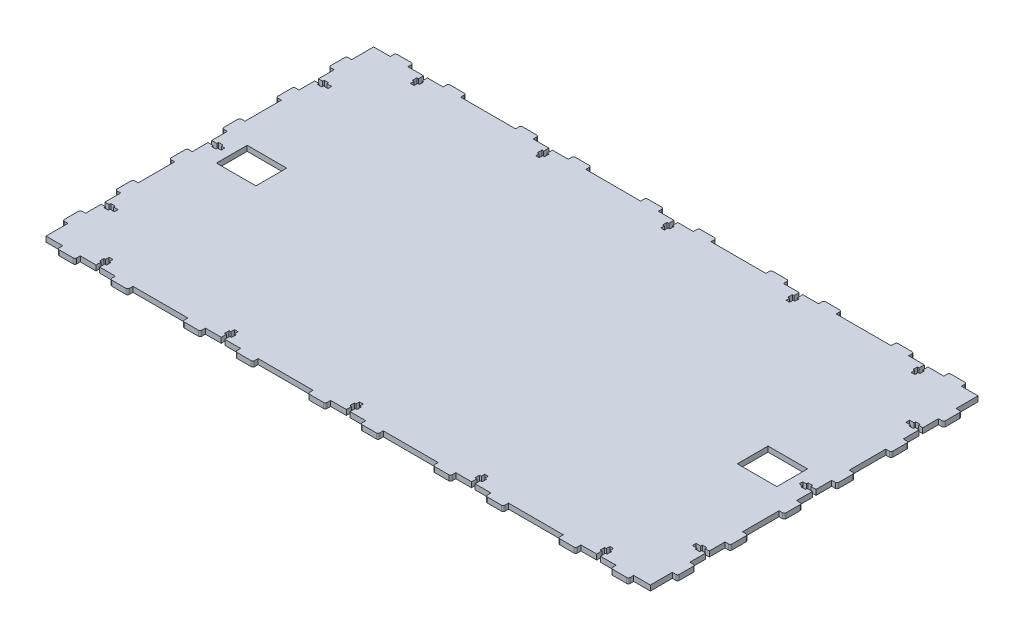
SolidWorks part; units mm, degrees
ref_plane "Спереди" through (0, 0, 0) normal (0, 0, 1) x (1, 0, 0)
ref_plane "Сверху" through (0, 0, 0) normal (0, 1, 0) x (1, 0, 0)
ref_plane "Справа" through (0, 0, 0) normal (1, 0, 0) x (0, 0, -1)
sketch "Эскиз1" plane through (0, 0, 0) normal (0, 1, 0) x (1, 0, 0)
  line L0 (344, 373) -> (344, 471.322) construction
  line L1 (0, 0) -> (688, 0)
  line L2 (0, 0) -> (0, 373)
  line L3 (0, 373) -> (688, 373)
  line L4 (688, 0) -> (688, 373)
  line L5 (19, 373) -> (39, 373)
  line L6 (19, 373) -> (19, 377)
  line L7 (21, 379) -> (37, 379)
  line L8 (39, 373) -> (39, 377)
  line L9 (79, 373) -> (99, 373)
  line L10 (79, 373) -> (79, 377)
  line L11 (81, 379) -> (97, 379)
  line L12 (99, 373) -> (99, 377)
  line L13 (161.5, 373) -> (181.5, 373)
  line L14 (161.5, 373) -> (161.5, 377)
  line L15 (163.5, 379) -> (179.5, 379)
  line L16 (181.5, 373) -> (181.5, 377)
  line L17 (221.5, 373) -> (241.5, 373)
  line L18 (221.5, 373) -> (221.5, 377)
  line L19 (223.5, 379) -> (239.5, 379)
  line L20 (241.5, 373) -> (241.5, 377)
  line L21 (56.9, 373) -> (61.1, 373)
  line L22 (56.9, 373) -> (56.9, 358)
  line L23 (56.9, 358) -> (61.1, 358)
  line L24 (61.1, 373) -> (61.1, 358)
  line L25 (55, 367.1) -> (63, 367.1)
  line L26 (55, 367.1) -> (55, 362)
  line L27 (55, 362) -> (63, 362)
  line L28 (63, 367.1) -> (63, 362)
  line L29 (199.5, 373) -> (203.5, 373)
  line L30 (199.5, 373) -> (199.5, 358)
  line L31 (199.5, 358) -> (203.5, 358)
  line L32 (203.5, 373) -> (203.5, 358)
  line L33 (197.5, 367.1) -> (205.5, 367.1)
  line L34 (197.5, 367.1) -> (197.5, 362)
  line L35 (197.5, 362) -> (205.5, 362)
  line L36 (205.5, 367.1) -> (205.5, 362)
  line L37 (341.9, 373) -> (346.1, 373)
  line L38 (341.9, 373) -> (341.9, 358)
  line L39 (341.9, 358) -> (346.1, 358)
  line L40 (346.1, 373) -> (346.1, 358)
  line L41 (340, 367.1) -> (348, 367.1)
  line L42 (340, 367.1) -> (340, 362)
  line L43 (340, 362) -> (348, 362)
  line L44 (348, 367.1) -> (348, 362)
  line L45 (304, 373) -> (324, 373)
  line L46 (304, 373) -> (304, 377)
  line L47 (306, 379) -> (322, 379)
  line L48 (324, 373) -> (324, 377)
  line L49 (364, 373) -> (364, 377)
  line L50 (382, 379) -> (366, 379)
  line L51 (384, 373) -> (384, 377)
  line L52 (384, 373) -> (364, 373)
  line L53 (482.5, 367.1) -> (482.5, 362)
  line L54 (490.5, 362) -> (482.5, 362)
  line L55 (490.5, 367.1) -> (490.5, 362)
  line L56 (490.5, 367.1) -> (482.5, 367.1)
  line L57 (484.5, 373) -> (484.5, 358)
  line L58 (488.5, 358) -> (484.5, 358)
  line L59 (488.5, 373) -> (488.5, 358)
  line L60 (488.5, 373) -> (484.5, 373)
  line L61 (625, 367.1) -> (625, 362)
  line L62 (633, 362) -> (625, 362)
  line L63 (633, 367.1) -> (633, 362)
  line L64 (633, 367.1) -> (625, 367.1)
  line L65 (626.9, 373) -> (626.9, 358)
  line L66 (631.1, 358) -> (626.9, 358)
  line L67 (631.1, 373) -> (631.1, 358)
  line L68 (631.1, 373) -> (626.9, 373)
  line L69 (446.5, 373) -> (446.5, 377)
  line L70 (464.5, 379) -> (448.5, 379)
  line L71 (466.5, 373) -> (466.5, 377)
  line L72 (466.5, 373) -> (446.5, 373)
  line L73 (506.5, 373) -> (506.5, 377)
  line L74 (524.5, 379) -> (508.5, 379)
  line L75 (526.5, 373) -> (526.5, 377)
  line L76 (526.5, 373) -> (506.5, 373)
  line L77 (589, 373) -> (589, 377)
  line L78 (607, 379) -> (591, 379)
  line L79 (609, 373) -> (609, 377)
  line L80 (609, 373) -> (589, 373)
  line L81 (649, 373) -> (649, 377)
  line L82 (667, 379) -> (651, 379)
  line L83 (669, 373) -> (669, 377)
  line L84 (669, 373) -> (649, 373)
  line L85 (0, 186.5) -> (-202.9722, 186.5) construction
  line L86 (344, 0) -> (344, -98.322) construction
  line L87 (669, 0) -> (649, 0)
  line L88 (669, 0) -> (669, -4)
  line L89 (667, -6) -> (651, -6)
  line L90 (649, 0) -> (649, -4)
  line L91 (609, 0) -> (589, 0)
  line L92 (609, 0) -> (609, -4)
  line L93 (607, -6) -> (591, -6)
  line L94 (589, 0) -> (589, -4)
  line L95 (526.5, 0) -> (506.5, 0)
  line L96 (526.5, 0) -> (526.5, -4)
  line L97 (524.5, -6) -> (508.5, -6)
  line L98 (506.5, 0) -> (506.5, -4)
  line L99 (466.5, 0) -> (446.5, 0)
  line L100 (466.5, 0) -> (466.5, -4)
  line L101 (464.5, -6) -> (448.5, -6)
  line L102 (446.5, 0) -> (446.5, -4)
  line L103 (631.1, 0) -> (626.9, 0)
  line L104 (631.1, 0) -> (631.1, 15)
  line L105 (631.1, 15) -> (626.9, 15)
  line L106 (626.9, 0) -> (626.9, 15)
  line L107 (633, 5.9) -> (625, 5.9)
  line L108 (633, 5.9) -> (633, 11)
  line L109 (633, 11) -> (625, 11)
  line L110 (625, 5.9) -> (625, 11)
  line L111 (488.5, 0) -> (484.5, 0)
  line L112 (488.5, 0) -> (488.5, 15)
  line L113 (488.5, 15) -> (484.5, 15)
  line L114 (484.5, 0) -> (484.5, 15)
  line L115 (490.5, 5.9) -> (482.5, 5.9)
  line L116 (490.5, 5.9) -> (490.5, 11)
  line L117 (490.5, 11) -> (482.5, 11)
  line L118 (482.5, 5.9) -> (482.5, 11)
  line L119 (384, 0) -> (364, 0)
  line L120 (384, 0) -> (384, -4)
  line L121 (382, -6) -> (366, -6)
  line L122 (364, 0) -> (364, -4)
  line L123 (324, 0) -> (324, -4)
  line L124 (306, -6) -> (322, -6)
  line L125 (304, 0) -> (304, -4)
  line L126 (304, 0) -> (324, 0)
  line L127 (348, 5.9) -> (348, 11)
  line L128 (340, 11) -> (348, 11)
  line L129 (340, 5.9) -> (340, 11)
  line L130 (340, 5.9) -> (348, 5.9)
  line L131 (346.1, 0) -> (346.1, 15)
  line L132 (341.9, 15) -> (346.1, 15)
  line L133 (341.9, 0) -> (341.9, 15)
  line L134 (341.9, 0) -> (346.1, 0)
  line L135 (205.5, 5.9) -> (205.5, 11)
  line L136 (197.5, 11) -> (205.5, 11)
  line L137 (197.5, 5.9) -> (197.5, 11)
  line L138 (197.5, 5.9) -> (205.5, 5.9)
  line L139 (203.5, 0) -> (203.5, 15)
  line L140 (199.5, 15) -> (203.5, 15)
  line L141 (199.5, 0) -> (199.5, 15)
  line L142 (199.5, 0) -> (203.5, 0)
  line L143 (63, 5.9) -> (63, 11)
  line L144 (55, 11) -> (63, 11)
  line L145 (55, 5.9) -> (55, 11)
  line L146 (55, 5.9) -> (63, 5.9)
  line L147 (61.1, 0) -> (61.1, 15)
  line L148 (56.9, 15) -> (61.1, 15)
  line L149 (56.9, 0) -> (56.9, 15)
  line L150 (56.9, 0) -> (61.1, 0)
  line L151 (241.5, 0) -> (241.5, -4)
  line L152 (223.5, -6) -> (239.5, -6)
  line L153 (221.5, 0) -> (221.5, -4)
  line L154 (221.5, 0) -> (241.5, 0)
  line L155 (181.5, 0) -> (181.5, -4)
  line L156 (163.5, -6) -> (179.5, -6)
  line L157 (161.5, 0) -> (161.5, -4)
  line L158 (161.5, 0) -> (181.5, 0)
  line L159 (99, 0) -> (99, -4)
  line L160 (81, -6) -> (97, -6)
  line L161 (79, 0) -> (79, -4)
  line L162 (79, 0) -> (99, 0)
  line L163 (39, 0) -> (39, -4)
  line L164 (21, -6) -> (37, -6)
  line L165 (19, 0) -> (19, -4)
  line L166 (19, 0) -> (39, 0)
  line L167 (9.9, 61) -> (9.9, 69)
  line L168 (0, 348) -> (-4, 348)
  line L169 (0, 348) -> (0, 328)
  line L170 (0, 328) -> (-4, 328)
  line L171 (-6, 346) -> (-6, 330)
  line L172 (0, 288) -> (-4, 288)
  line L173 (0, 288) -> (0, 268)
  line L174 (0, 268) -> (-4, 268)
  line L175 (-6, 286) -> (-6, 270)
  line L176 (0, 226.5) -> (-4, 226.5)
  line L177 (0, 226.5) -> (0, 206.5)
  line L178 (0, 206.5) -> (-4, 206.5)
  line L179 (-6, 224.5) -> (-6, 208.5)
  line L180 (0, 310.1) -> (15, 310.1)
  line L181 (0, 310.1) -> (0, 305.9)
  line L182 (0, 305.9) -> (15, 305.9)
  line L183 (15, 310.1) -> (15, 305.9)
  line L184 (4.8, 312) -> (9.9, 312)
  line L185 (4.8, 312) -> (4.8, 304)
  line L186 (4.8, 304) -> (9.9, 304)
  line L187 (9.9, 312) -> (9.9, 304)
  line L188 (0, 184.4) -> (15, 184.4)
  line L189 (0, 184.4) -> (0, 188.6)
  line L190 (0, 188.6) -> (15, 188.6)
  line L191 (15, 184.4) -> (15, 188.6)
  line L192 (11, 190.5) -> (5.9, 190.5)
  line L193 (11, 190.5) -> (11, 182.5)
  line L194 (11, 182.5) -> (5.9, 182.5)
  line L195 (5.9, 190.5) -> (5.9, 182.5)
  line L196 (4.8, 69) -> (9.9, 69)
  line L197 (4.8, 61) -> (4.8, 69)
  line L198 (4.8, 61) -> (9.9, 61)
  line L199 (15, 62.9) -> (15, 67.1)
  line L200 (0, 67.1) -> (15, 67.1)
  line L201 (0, 62.9) -> (0, 67.1)
  line L202 (0, 62.9) -> (15, 62.9)
  line L203 (-6, 148.5) -> (-6, 164.5)
  line L204 (0, 166.5) -> (-4, 166.5)
  line L205 (0, 146.5) -> (0, 166.5)
  line L206 (0, 146.5) -> (-4, 146.5)
  line L207 (-6, 87) -> (-6, 103)
  line L208 (0, 105) -> (-4, 105)
  line L209 (0, 85) -> (0, 105)
  line L210 (0, 85) -> (-4, 85)
  line L211 (-6, 27) -> (-6, 43)
  line L212 (0, 45) -> (-4, 45)
  line L213 (0, 25) -> (0, 45)
  line L214 (0, 25) -> (-4, 25)
  line L215 (688, 25) -> (692, 25)
  line L216 (688, 25) -> (688, 45)
  line L217 (688, 45) -> (692, 45)
  line L218 (694, 27) -> (694, 43)
  line L219 (688, 85) -> (692, 85)
  line L220 (688, 85) -> (688, 105)
  line L221 (688, 105) -> (692, 105)
  line L222 (694, 87) -> (694, 103)
  line L223 (688, 62.9) -> (673, 62.9)
  line L224 (688, 62.9) -> (688, 67.1)
  line L225 (688, 67.1) -> (673, 67.1)
  line L226 (673, 62.9) -> (673, 67.1)
  line L227 (683.2, 61) -> (678.1, 61)
  line L228 (683.2, 61) -> (683.2, 69)
  line L229 (683.2, 69) -> (678.1, 69)
  line L230 (678.1, 61) -> (678.1, 69)
  line L231 (688, 146.5) -> (692, 146.5)
  line L232 (688, 146.5) -> (688, 166.5)
  line L233 (688, 166.5) -> (692, 166.5)
  line L234 (694, 148.5) -> (694, 164.5)
  line L235 (682.1, 190.5) -> (682.1, 182.5)
  line L236 (677, 182.5) -> (682.1, 182.5)
  line L237 (677, 190.5) -> (677, 182.5)
  line L238 (677, 190.5) -> (682.1, 190.5)
  line L239 (673, 184.4) -> (673, 188.6)
  line L240 (688, 188.6) -> (673, 188.6)
  line L241 (688, 184.4) -> (688, 188.6)
  line L242 (688, 184.4) -> (673, 184.4)
  line L243 (678.1, 312) -> (678.1, 304)
  line L244 (683.2, 304) -> (678.1, 304)
  line L245 (683.2, 312) -> (683.2, 304)
  line L246 (683.2, 312) -> (678.1, 312)
  line L247 (673, 310.1) -> (673, 305.9)
  line L248 (688, 305.9) -> (673, 305.9)
  line L249 (688, 310.1) -> (688, 305.9)
  line L250 (688, 310.1) -> (673, 310.1)
  line L251 (694, 224.5) -> (694, 208.5)
  line L252 (688, 206.5) -> (692, 206.5)
  line L253 (688, 226.5) -> (688, 206.5)
  line L254 (688, 226.5) -> (692, 226.5)
  line L255 (694, 286) -> (694, 270)
  line L256 (688, 268) -> (692, 268)
  line L257 (688, 288) -> (688, 268)
  line L258 (688, 288) -> (692, 288)
  line L259 (694, 346) -> (694, 330)
  line L260 (688, 328) -> (692, 328)
  line L261 (688, 348) -> (688, 328)
  line L262 (688, 348) -> (692, 348)
  arc A0 (322, 379) -> (324, 377) centre (322, 377) cw
  arc A1 (304, 377) -> (306, 379) centre (306, 377) cw
  arc A2 (239.5, 379) -> (241.5, 377) centre (239.5, 377) cw
  arc A3 (221.5, 377) -> (223.5, 379) centre (223.5, 377) cw
  arc A4 (179.5, 379) -> (181.5, 377) centre (179.5, 377) cw
  arc A5 (161.5, 377) -> (163.5, 379) centre (163.5, 377) cw
  arc A6 (97, 379) -> (99, 377) centre (97, 377) cw
  arc A7 (79, 377) -> (81, 379) centre (81, 377) cw
  arc A8 (37, 379) -> (39, 377) centre (37, 377) cw
  arc A9 (19, 377) -> (21, 379) centre (21, 377) cw
  arc A10 (669, 377) -> (667, 379) centre (667, 377) ccw
  arc A11 (651, 379) -> (649, 377) centre (651, 377) ccw
  arc A12 (609, 377) -> (607, 379) centre (607, 377) ccw
  arc A13 (591, 379) -> (589, 377) centre (591, 377) ccw
  arc A14 (526.5, 377) -> (524.5, 379) centre (524.5, 377) ccw
  arc A15 (508.5, 379) -> (506.5, 377) centre (508.5, 377) ccw
  arc A16 (466.5, 377) -> (464.5, 379) centre (464.5, 377) ccw
  arc A17 (448.5, 379) -> (446.5, 377) centre (448.5, 377) ccw
  arc A18 (384, 377) -> (382, 379) centre (382, 377) ccw
  arc A19 (366, 379) -> (364, 377) centre (366, 377) ccw
  arc A20 (366, -6) -> (364, -4) centre (366, -4) cw
  arc A21 (384, -4) -> (382, -6) centre (382, -4) cw
  arc A22 (448.5, -6) -> (446.5, -4) centre (448.5, -4) cw
  arc A23 (466.5, -4) -> (464.5, -6) centre (464.5, -4) cw
  arc A24 (508.5, -6) -> (506.5, -4) centre (508.5, -4) cw
  arc A25 (526.5, -4) -> (524.5, -6) centre (524.5, -4) cw
  arc A26 (591, -6) -> (589, -4) centre (591, -4) cw
  arc A27 (609, -4) -> (607, -6) centre (607, -4) cw
  arc A28 (651, -6) -> (649, -4) centre (651, -4) cw
  arc A29 (669, -4) -> (667, -6) centre (667, -4) cw
  arc A30 (19, -4) -> (21, -6) centre (21, -4) ccw
  arc A31 (37, -6) -> (39, -4) centre (37, -4) ccw
  arc A32 (79, -4) -> (81, -6) centre (81, -4) ccw
  arc A33 (97, -6) -> (99, -4) centre (97, -4) ccw
  arc A34 (161.5, -4) -> (163.5, -6) centre (163.5, -4) ccw
  arc A35 (179.5, -6) -> (181.5, -4) centre (179.5, -4) ccw
  arc A36 (221.5, -4) -> (223.5, -6) centre (223.5, -4) ccw
  arc A37 (239.5, -6) -> (241.5, -4) centre (239.5, -4) ccw
  arc A38 (304, -4) -> (306, -6) centre (306, -4) ccw
  arc A39 (322, -6) -> (324, -4) centre (322, -4) ccw
  arc A40 (-4, 206.5) -> (-6, 208.5) centre (-4, 208.5) cw
  arc A41 (-4, 226.5) -> (-6, 224.5) centre (-4, 224.5) ccw
  arc A42 (-4, 268) -> (-6, 270) centre (-4, 270) cw
  arc A43 (-4, 288) -> (-6, 286) centre (-4, 286) ccw
  arc A44 (-4, 328) -> (-6, 330) centre (-4, 330) cw
  arc A45 (-4, 348) -> (-6, 346) centre (-4, 346) ccw
  arc A46 (-4, 25) -> (-6, 27) centre (-4, 27) cw
  arc A47 (-4, 45) -> (-6, 43) centre (-4, 43) ccw
  arc A48 (-4, 85) -> (-6, 87) centre (-4, 87) cw
  arc A49 (-4, 105) -> (-6, 103) centre (-4, 103) ccw
  arc A50 (-4, 146.5) -> (-6, 148.5) centre (-4, 148.5) cw
  arc A51 (-4, 166.5) -> (-6, 164.5) centre (-4, 164.5) ccw
  arc A52 (692, 105) -> (694, 103) centre (692, 103) cw
  arc A53 (692, 85) -> (694, 87) centre (692, 87) ccw
  arc A54 (692, 45) -> (694, 43) centre (692, 43) cw
  arc A55 (692, 25) -> (694, 27) centre (692, 27) ccw
  arc A56 (692, 166.5) -> (694, 164.5) centre (692, 164.5) cw
  arc A57 (692, 146.5) -> (694, 148.5) centre (692, 148.5) ccw
  arc A58 (692, 348) -> (694, 346) centre (692, 346) cw
  arc A59 (692, 328) -> (694, 330) centre (692, 330) ccw
  arc A60 (692, 288) -> (694, 286) centre (692, 286) cw
  arc A61 (692, 268) -> (694, 270) centre (692, 270) ccw
  arc A62 (692, 226.5) -> (694, 224.5) centre (692, 224.5) cw
  arc A63 (692, 206.5) -> (694, 208.5) centre (692, 208.5) ccw
  point P49 (59, 358)
  point P50 (59, 362)
  point P51 (344, 373)
  point P52 (344, 358)
  point P53 (344, 362)
  point P54 (201.5, 358)
  point P55 (201.5, 362)
  point P60 (324, 379)
  point P63 (304, 379)
  point P66 (241.5, 379)
  point P69 (221.5, 379)
  point P72 (181.5, 379)
  point P75 (161.5, 379)
  point P78 (99, 379)
  point P81 (79, 379)
  point P84 (39, 379)
  point P87 (19, 379)
  point P144 (669, 379)
  point P145 (649, 379)
  point P146 (609, 379)
  point P147 (589, 379)
  point P148 (526.5, 379)
  point P149 (506.5, 379)
  point P150 (466.5, 379)
  point P151 (446.5, 379)
  point P152 (384, 379)
  point P153 (364, 379)
  point P154 (486.5, 362)
  point P155 (486.5, 358)
  point P156 (629, 362)
  point P157 (629, 358)
  point P282 (629, 15)
  point P283 (629, 11)
  point P284 (486.5, 15)
  point P285 (486.5, 11)
  point P286 (364, -6)
  point P287 (384, -6)
  point P288 (446.5, -6)
  point P289 (466.5, -6)
  point P290 (506.5, -6)
  point P291 (526.5, -6)
  point P292 (589, -6)
  point P293 (609, -6)
  point P294 (649, -6)
  point P295 (669, -6)
  point P296 (19, -6)
  point P297 (39, -6)
  point P298 (79, -6)
  point P299 (99, -6)
  point P300 (161.5, -6)
  point P301 (181.5, -6)
  point P302 (221.5, -6)
  point P303 (241.5, -6)
  point P304 (304, -6)
  point P305 (324, -6)
  point P306 (201.5, 11)
  point P307 (201.5, 15)
  point P308 (344, 11)
  point P309 (344, 15)
  point P310 (59, 11)
  point P311 (59, 15)
  point P340 (9.9, 308)
  point P341 (15, 308)
  point P342 (15, 186.5)
  point P343 (11, 186.5)
  point P346 (-6, 206.5)
  point P349 (-6, 226.5)
  point P352 (-6, 268)
  point P355 (-6, 288)
  point P358 (-6, 328)
  point P361 (-6, 348)
  point P394 (-6, 25)
  point P395 (-6, 45)
  point P396 (-6, 85)
  point P397 (-6, 105)
  point P398 (-6, 146.5)
  point P399 (-6, 166.5)
  point P400 (15, 65)
  point P401 (9.9, 65)
  point P426 (678.1, 65)
  point P427 (673, 65)
  point P428 (694, 105)
  point P429 (694, 85)
  point P430 (694, 45)
  point P431 (694, 25)
  point P480 (694, 166.5)
  point P481 (694, 146.5)
  point P482 (694, 348)
  point P483 (694, 328)
  point P484 (694, 288)
  point P485 (694, 268)
  point P486 (694, 226.5)
  point P487 (694, 206.5)
  point P488 (677, 186.5)
  point P489 (673, 186.5)
  point P490 (673, 308)
  point P491 (678.1, 308)
extrude "Бобышка-Вытянуть1" add sketch "Эскиз1" along normal blind 6 contours L164 A31 L163 L1 L165 A30 | L212 A47 L211 A46 L214 L2 | L160 A33 L159 L1 L161 A32 | L156 A35 L155 L1 L157 A34 | L208 A49 L207 A48 L210 L2 | L204 A51 L203 A50 L206 L2 | L176 A41 L179 A40 L178 L2 | L172 A43 L175 A42 L174 L2 | A9 L6 L3 L8 A8 L7 | A7 L10 L3 L12 A6 L11 | A5 L14 L3 L16 A4 L15 | A3 L18 L3 L20 A2 L19 | A1 L46 L3 L48 A0 L47 | L50 A19 L49 L3 L51 A18 | L70 A17 L69 L3 L71 A16 | L74 A15 L73 L3 L75 A14 | L78 A13 L77 L3 L79 A12 | L82 A11 L81 L3 L83 A10 | L260 A59 L259 A58 L262 L4 | L256 A61 L255 A60 L258 L4 | L252 A63 L251 A62 L254 L4 | L231 A57 L234 A56 L233 L4 | L219 A53 L222 A52 L221 L4 | L215 A55 L218 A54 L217 L4 | A29 L88 L1 L90 A28 L89 | A27 L92 L1 L94 A26 L93 | A25 L96 L1 L98 A24 L97 | A23 L100 L1 L102 A22 L101 | A21 L120 L1 L122 A20 L121 | L124 A39 L123 L1 L125 A38 | L152 A37 L151 L1 L153 A36 | L250 L4 L3 L67 L64 L63 L62 L66 L65 L61 L59 L56 L55 L54 L58 L57 L53 L40 L41 L44 L43 L39 L38 L42 | L171 A44 L170 L169 L168 A45
sketch "Эскиз2" plane through (0, 6, 0) normal (0, 1, 0) x (1, 0, 0)
  line L0 (0, 105) -> (0, 146.5) construction
  line L1 (25, 204) -> (70, 204)
  line L2 (25, 204) -> (25, 169)
  line L3 (25, 169) -> (70, 169)
  line L4 (70, 204) -> (70, 169)
  line L5 (663, 204) -> (618, 204)
  line L6 (663, 204) -> (663, 169)
  line L7 (663, 169) -> (618, 169)
  line L8 (618, 204) -> (618, 169)
  line L9 (15, 184.4) -> (15, 188.6) construction
  line L10 (688, 105) -> (688, 146.5) construction
  point P10 (25, 186.5)
  point P11 (15, 186.5)
  point P16 (663, 186.5)
  dimension "D1" = 35
  dimension "D2" = 45
  dimension "D3" = 25
  dimension "D4" = 45
  dimension "D5" = 35
  dimension "D6" = 25
extrude "Вырез-Вытянуть1" cut sketch "Эскиз2" against normal through all
equation "\"D14@Эскиз1\"=\"D8@Эскиз1\"/2"
equation "\"D33@Эскиз1\"=\"D32@Эскиз1\"/2"
equation "\"D35@Эскиз1\"=\"D34@Эскиз1\"/2"
equation "\"D48@Эскиз1\"=\"D42@Эскиз1\"/2"
